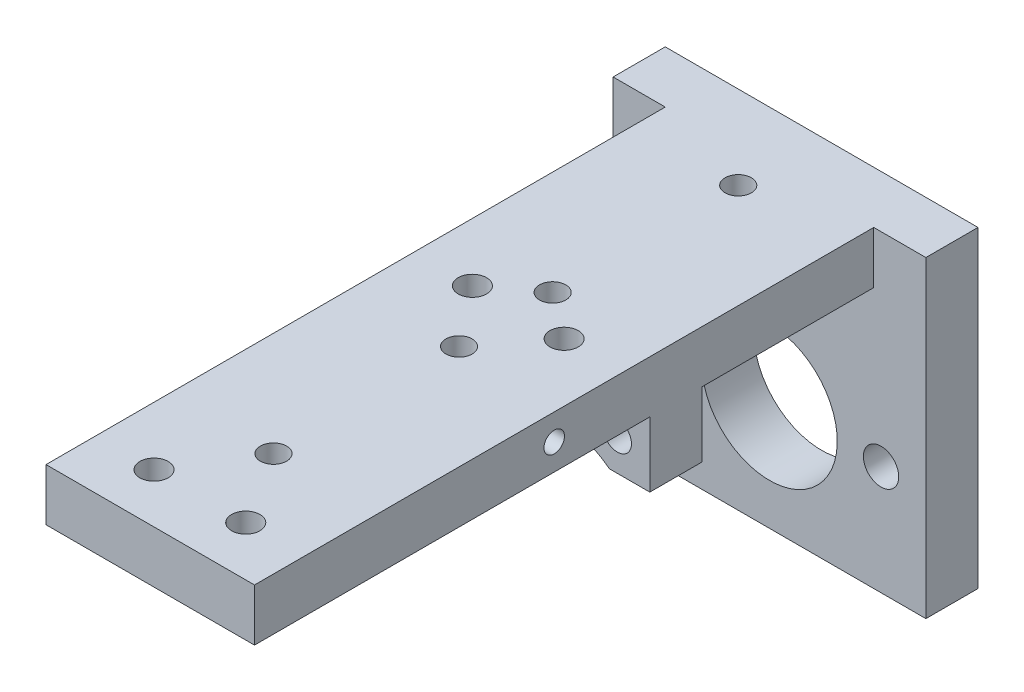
SolidWorks part; units mm, degrees
ref_plane "Front Plane" through (0, 0, 0) normal (0, 0, 1) x (1, 0, 0)
ref_plane "Top Plane" through (0, 0, 0) normal (0, 1, 0) x (1, 0, 0)
ref_plane "Right Plane" through (0, 0, 0) normal (1, 0, 0) x (0, 0, -1)
sketch "Sketch1" plane through (0, 0, 0) normal (1, 0, 0) x (0, 0, -1)
  line L0 (0, 0) -> (-81.788, 0)
  line L1 (0, 0) -> (0, -38.1)
  line L2 (-6.35, -6.35) -> (-81.788, -6.35)
  line L3 (-6.35, -6.35) -> (-6.35, -38.1)
  line L4 (-81.788, -6.35) -> (-81.788, 0)
  line L5 (-6.35, -38.1) -> (0, -38.1)
  dimension "D2" = 81.788
  dimension "D3" = 38.1
  dimension "D1" = 6.35
extrude "Extrude1" add sketch "Sketch1" along normal mid plane 38.1
sketch "Sketch2" plane through (0, 0, 0) normal (0, 0, -1) x (-1, 0, 0)
  line L0 (-19.05, 0) -> (19.05, 0) construction
  circle A0 centre (0, -24.7904) radius 8.255
  dimension "D2" = 16.51
  dimension "D1" = 24.7904
extrude "Cut-Extrude1" cut sketch "Sketch2" against normal up to next
hole_wizard "#8 Clearance Hole1" positions "3DSketch1" profile "Sketch3" hole size "#8" standard "Ansi Inch"
sketch3d "3DSketch1"
  line L0 (19.05, 0, 0) -> (-19.05, 0, 0) construction
  circle A0 centre (0, -24.7904, 0) radius 8.255 construction
  point P0 (13.589, -24.7904, 0)
  point P2 (-13.589, -24.7904, 0)
  point P11 (0, -24.7904, -8.255)
  dimension "D1" = 27.178
  dimension "D2" = 24.7904
  dimension "D3" = 13.589
sketch "Sketch3" plane through (13.589, -24.7904, 0) normal (1, 0, 0) x (0, 1, 0)
  line L0 (0, 0) -> (0, 37.8694)
  line L1 (0, 37.8694) -> (2.1526, 36.576)
  line L2 (2.1526, 36.576) -> (2.1526, 0)
  line L5 (2.1526, 0) -> (0, 0)
  line L10 (0, 37.8694) -> (-2.1527, 36.576) construction
  line L11 (0, -6.35) -> (0, 107.95) construction
  dimension "Hole Dia." = 4.3053
  dimension "Hole Depth" = 36.576
  dimension "Drill Angle" = 118
hole_wizard "CBORE for M3 SHCS2" positions "3DSketch3" profile "Sketch5" counterbore size "M3" standard "Ansi Metric"
sketch3d "3DSketch3"
  line L2 (-19.05, -6.35, 81.788) -> (-19.05, -6.35, 6.35) construction
  line L4 (19.05, -6.35, 6.35) -> (-19.05, -6.35, 6.35) construction
  point P0 (0, -6.35, 32.766)
  point P2 (0, -6.35, 66.7766)
  point P15 (0, -6.35, 10.16)
  point P17 (0, -6.35, 44.1706)
  dimension "D1" = 32.766
  dimension "D2" = 19.05
  dimension "D3" = 34.0106
  dimension "D4" = 3.81
  dimension "D5" = 37.8206
sketch "Sketch5" plane through (0, -6.35, 32.766) normal (1, 0, 0) x (0, 0, -1)
  line L0 (0, 0) -> (0, 6.35)
  line L1 (0, 6.35) -> (1.6, 6.35)
  line L3 (1.6, 6.35) -> (1.6, 3)
  line L4 (1.6, 3) -> (3.25, 3)
  line L5 (3.25, 3) -> (3.25, 0)
  line L7 (3.25, 0) -> (0, 0)
  line L11 (0, -6.35) -> (0, 107.95) construction
  dimension "Thru Hole Dia." = 3.2
  dimension "Thru Hole Depth" = 6.35
  dimension "C'Bore Dia." = 6.5
  dimension "C'Bore Depth" = 3
sketch "Sketch6" plane through (0, -6.35, 0) normal (0, -1, 0) x (1, 0, 0)
  line L0 (19.05, 6.35) -> (-19.05, 6.35) construction
  line L1 (19.05, 81.788) -> (12.7, 81.788)
  line L2 (19.05, 81.788) -> (19.05, 6.35)
  line L3 (19.05, 6.35) -> (12.7, 6.35)
  line L4 (12.7, 81.788) -> (12.7, 6.35)
  line L5 (19.05, 6.35) -> (-19.05, 6.35) construction
  line L6 (-19.05, 81.788) -> (-12.7, 81.788)
  line L7 (-19.05, 81.788) -> (-19.05, 6.35)
  line L8 (-19.05, 6.35) -> (-12.7, 6.35)
  line L9 (-12.7, 81.788) -> (-12.7, 6.35)
  dimension "D1" = 6.35
  dimension "D2" = 6.35
extrude "Cut-Extrude2" cut sketch "Sketch6" against normal through all
sketch "Sketch7" plane through (12.7, 0, 0) normal (1, 0, 0) x (0, 0, -1)
  line L0 (-81.788, -6.35) -> (-6.35, -6.35) construction
  line L1 (-27.2796, -6.35) -> (-33.6296, -6.35)
  line L2 (-27.2796, -6.35) -> (-27.2796, -14.2875)
  line L3 (-27.2796, -14.2875) -> (-33.6296, -14.2875)
  line L4 (-33.6296, -6.35) -> (-33.6296, -14.2875)
  line L5 (0, -38.1) -> (0, 0) construction
  dimension "D1" = 7.9375
  dimension "D2" = 6.35
  dimension "D3" = 33.6296
extrude "Extrude2" add sketch "Sketch7" against normal up to surface (25.4 mm away)
sketch "Sketch8" plane through (0, -14.2875, 0) normal (0, -1, 0) x (1, 0, 0)
  circle A0 centre (0, 32.766) radius 3.25
extrude "Cut-Extrude3" cut sketch "Sketch8" against normal up to next
hole_wizard "#8-32 Tapped Hole1" positions "3DSketch4" profile "Sketch9" tap size "#8-32" standard "Ansi Inch"
sketch3d "3DSketch4"
  line L0 (-12.7, -6.35, 33.6296) -> (-3.1332, -6.35, 33.6296) construction
  line L4 (-12.7, -14.2875, 33.6296) -> (-12.7, -6.35, 33.6296) construction
  line L5 (12.7, -6.35, 33.6296) -> (12.7, -14.2875, 33.6296) construction
  point P0 (-8.7376, -10.3124, 33.6296)
  point P2 (8.7376, -10.3124, 33.6296)
  dimension "D1" = 3.9624
  dimension "D2" = 3.9624
  dimension "D4" = 3.9624
sketch "Sketch9" plane through (-8.7376, -10.3124, 33.6296) normal (1, 0, 0) x (0, -1, 0)
  line L0 (0, 0) -> (0, 13.3314)
  line L1 (0, 13.3314) -> (1.7272, 12.2936)
  line L2 (1.7272, 12.2936) -> (1.7272, 0)
  line L5 (1.7272, 0) -> (0, 0)
  line L10 (0, 13.3314) -> (-1.7272, 12.2936) construction
  line L11 (0, -6.35) -> (0, 107.95) construction
  dimension "Tap Drill Dia." = 3.4544
  dimension "Tap Drill Depth" = 12.2936
  dimension "Drill Angle" = 118
hole_wizard "#8-32 Tapped Hole2" positions "3DSketch5" profile "Sketch10" tap size "#8-32" standard "Ansi Inch"
sketch3d "3DSketch5"
  line L0 (19.05, 0, 0) -> (-19.05, 0, 0) construction
  line L1 (0, 0, 0) -> (0, 0, 81.788) construction
  line L2 (12.7, 0, 81.788) -> (-12.7, 0, 81.788) construction
  point P0 (-5.588, 0, 36.957)
  point P2 (5.588, 0, 36.957)
  point P4 (5.588, 0, 75.7428)
  point P6 (-5.588, 0, 75.7428)
  dimension "D1" = 36.957
  dimension "D2" = 38.7858
  dimension "D3" = 5.588
  dimension "D4" = 11.176
sketch "Sketch10" plane through (-5.588, 0, 36.957) normal (1, 0, 0) x (0, 0, 1)
  line L0 (0, 0) -> (0, 6.35)
  line L1 (0, 6.35) -> (1.7272, 6.35)
  line L2 (1.7272, 6.35) -> (1.7272, 0)
  line L5 (1.7272, 0) -> (0, 0)
  line L11 (0, -6.35) -> (0, 107.95) construction
  dimension "Thru Tap Drill Dia." = 3.4544
  dimension "Thru Tap Drill Depth" = 6.35
sketch "Sketch11" plane through (0, 0, 33.6296) normal (0, 0, 1) x (1, 0, 0)
  circle A0 centre (0, -24.7904) radius 13.081
  dimension "D1" = 26.162
extrude "Cut-Extrude4" cut sketch "Sketch11" against normal up to next
hole_wizard "M3x0.5 Tapped Hole1" positions "3DSketch6" profile "Sketch12" tap size "M3x0.5" standard "Ansi Metric"
sketch3d "3DSketch6"
  line L0 (19.05, -38.1, 0) -> (19.05, 0, 0) construction
  line L1 (12.7, 0, 81.788) -> (12.7, -6.35, 81.788) construction
  point P0 (12.7, -3.175, 45.2769)
  point P8 (12.7, -3.175, 81.788)
  dimension "D1" = 45.72
sketch "Sketch12" plane through (12.7, -3.175, 45.2769) normal (0, 1, 0) x (0, 0, -1)
  line L0 (0, 0) -> (0, 8.2441)
  line L1 (0, 8.2441) -> (1.25, 7.493)
  line L2 (1.25, 7.493) -> (1.25, 0)
  line L5 (1.25, 0) -> (0, 0)
  line L10 (0, 8.2441) -> (-1.25, 7.493) construction
  line L11 (0, -6.35) -> (0, 107.95) construction
  dimension "Tap Drill Dia." = 2.5
  dimension "Tap Drill Depth" = 7.493
  dimension "Drill Angle" = 118
hole_wizard "#8-32 Tapped Hole3" positions "3DSketch9" profile "Sketch15" tap size "#8-32" standard "Ansi Inch"
sketch3d "3DSketch9"
  line L0 (-19.05, 0, 0) -> (-19.05, 0, 6.35) construction
  line L1 (-19.05, -38.1, 0) -> (-19.05, 0, 0) construction
  point P0 (-19.05, -18.4404, 3.175)
  point P2 (-19.05, -31.1404, 3.175)
  dimension "D1" = 18.4404
  dimension "D2" = 3.175
  dimension "D3" = 12.7
sketch "Sketch15" plane through (-19.05, -18.4404, 3.175) normal (0, 1, 0) x (0, 0, 1)
  line L0 (0, 0) -> (0, 10.7188)
  line L1 (0, 10.7188) -> (1.7272, 10.7188)
  line L2 (1.7272, 10.7188) -> (1.7272, 0)
  line L5 (1.7272, 0) -> (0, 0)
  line L10 (0, 10.7188) -> (-1.7272, 10.7188) construction
  line L11 (0, -6.35) -> (0, 107.95) construction
  dimension "Tap Drill Dia." = 3.4544
  dimension "Tap Drill Depth" = 10.7188
  dimension "Drill Angle" = 180
